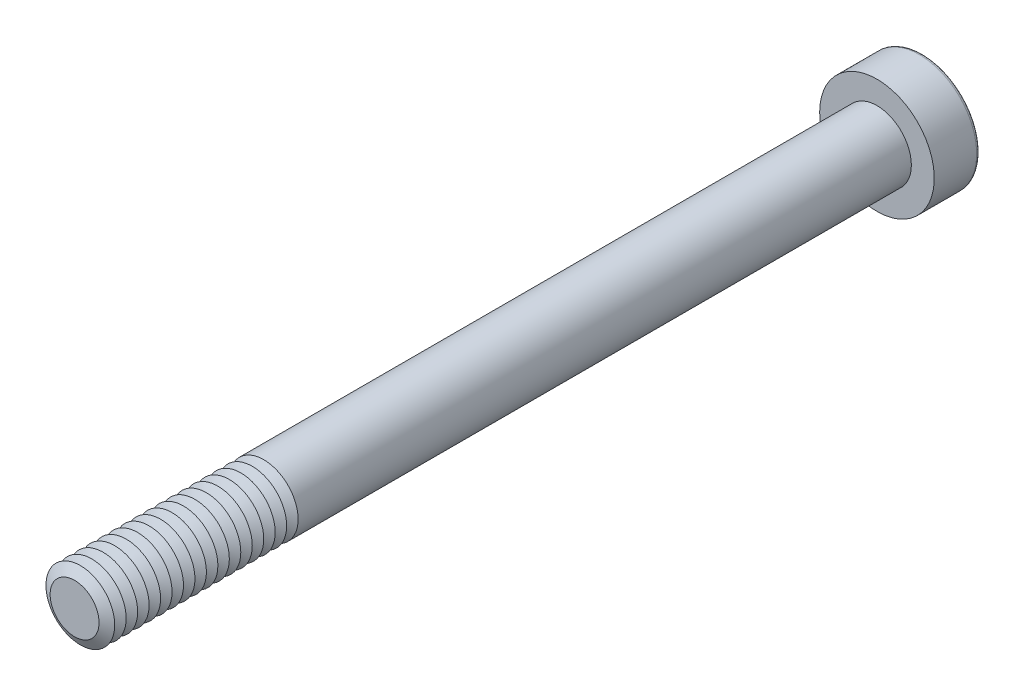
SolidWorks part; units mm, degrees
ref_plane "Front Plane" through (0, 0, 0) normal (0, 0, 1) x (1, 0, 0)
ref_plane "Top Plane" through (0, 0, 0) normal (0, 1, 0) x (1, 0, 0)
ref_plane "Right Plane" through (0, 0, 0) normal (1, 0, 0) x (0, 0, -1)
sketch "Sketch1" plane through (0, 0, 0) normal (0, 0, 1) x (1, 0, 0)
  circle A0 centre (0, 0) radius 3
  dimension "D1" = 6
extrude "Boss-Extrude1" add sketch "Sketch1" along normal blind 70
sketch "Sketch2" plane through (0, 0, 0) normal (0, 0, -1) x (-1, 0, 0)
  circle A0 centre (0, 0) radius 5
  dimension "D1" = 10
extrude "Boss-Extrude2" add sketch "Sketch2" along normal blind 4
sketch "Sketch3" plane through (0, 0, -4) normal (0, 0, -1) x (-1, 0, 0)
  line L1 (-1.1547, 2) -> (-2.3094, 0)
  line L2 (-2.3094, 0) -> (-1.1547, -2)
  line L3 (-1.1547, -2) -> (1.1547, -2)
  line L4 (1.1547, -2) -> (2.3094, 0)
  line L5 (2.3094, 0) -> (1.1547, 2)
  line L6 (1.1547, 2) -> (-1.1547, 2)
  circle A0 centre (0, 0) radius 2 construction
  dimension "D1" = 4
extrude "Cut-Extrude1" cut sketch "Sketch3" against normal blind 3
fillet "Fillet1" radius 0.3 1 edges at (-5, 0, -4)
sketch "Sketch4" plane through (0, 0, -1) normal (0, 0, -1) x (-1, 0, 0)
  line L0 (1.1547, -2) -> (2.3094, 0) construction
  circle A0 centre (0, 0) radius 2
extrude "Cut-Extrude2" cut sketch "Sketch4" against normal through all draft 60
sketch "Sketch5" plane through (0, 0, -4) normal (0, 0, -1) x (-1, 0, 0)
  circle A0 centre (0, 0) radius 2.3094
extrude "Cut-Extrude3" cut sketch "Sketch5" against normal through all draft 75
sketch "Sketch7" plane through (0, 0, 0) normal (1, 0, 0) x (0, 0, -1)
  line L25 (-70, 2.134) -> (-69.5, 3)
  line L26 (-70, 3) -> (-70, -3) construction
  line L27 (-69.5, 3) -> (-70.5, 3)
  line L28 (-70.5, 3) -> (-70, 2.134)
  line L29 (0, 3) -> (-70, 3) construction
  dimension "D1" = 1
revolve "Cut-Revolve1" cut sketch "Sketch7" angle 360 about axis through (0, 0, 70) along (0, 0, -1)
pattern_linear "LPattern1" count 17 spacing 1 along (0, 0, -1) of "Cut-Revolve1"
